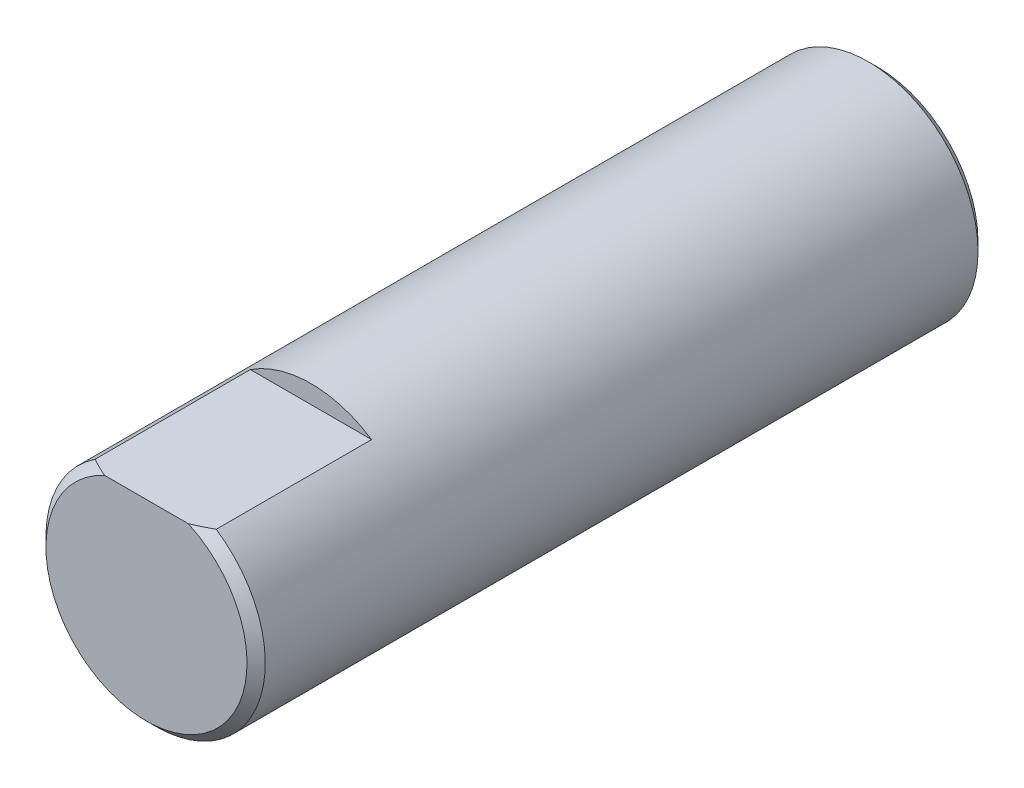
SolidWorks part; units mm, degrees
ref_plane "Plan de face" through (0, 0, 0) normal (0, 0, 1) x (1, 0, 0)
ref_plane "Plan de dessus" through (0, 0, 0) normal (0, 1, 0) x (1, 0, 0)
ref_plane "Plan de droite" through (0, 0, 0) normal (1, 0, 0) x (0, 0, -1)
sketch "Esquisse1" plane through (0, 0, 0) normal (0, 0, 1) x (1, 0, 0)
  circle A0 centre (0, 0) radius 6
  dimension "D1" = 12
extrude "Extrusion1" add sketch "Esquisse1" along normal mid plane 40
chamfer "Chanfrein1" distance 0.5 angle 45 2 edges at (6, 0, -20) (6, 0, 20)
sketch "Esquisse2" plane through (0, 0, 20) normal (0, 0, 1) x (1, 0, 0)
  line L0 (-3.3166, 5) -> (3.3166, 5)
  circle A0 centre (0, 0) radius 6 construction
  arc A1 (3.3166, 5) -> (-3.3166, 5) centre (0, 0) ccw
  dimension "D1" = 5
extrude "Enlèv. mat.-Extru.1" cut sketch "Esquisse2" against normal blind 9
